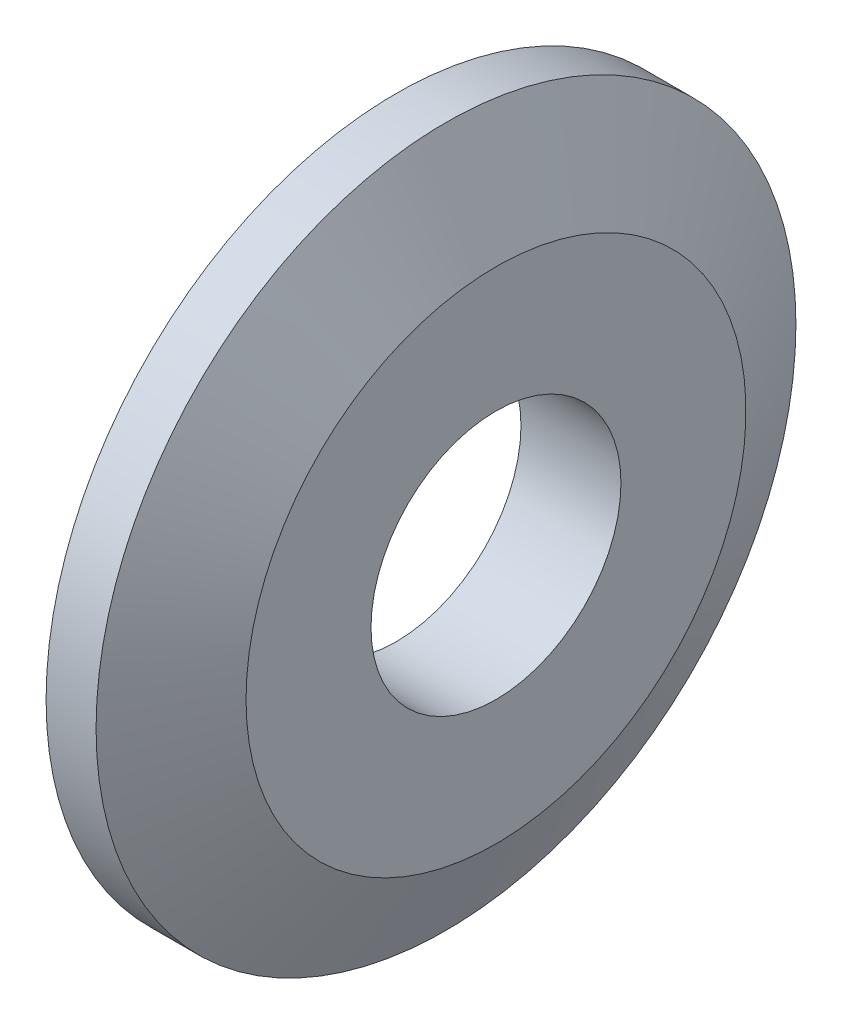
SolidWorks part; units mm, degrees
ref_plane "Plan de face" through (0, 0, 0) normal (0, 0, 1) x (1, 0, 0)
ref_plane "Plan de dessus" through (0, 0, 0) normal (0, 1, 0) x (1, 0, 0)
ref_plane "Plan de droite" through (0, 0, 0) normal (1, 0, 0) x (0, 0, -1)
sketch "Esquisse1" plane through (0, 0, 0) normal (0, 0, 1) x (1, 0, 0)
  line L0 (0, 2.5) -> (0, 7)
  line L1 (0, 7) -> (1, 7)
  line L2 (1, 7) -> (2, 5)
  line L3 (2, 5) -> (2, 2.5)
  line L4 (2, 2.5) -> (0, 2.5)
  line L5 (0, 0) -> (13.7083, 0) construction
  dimension "D1" = 7
  dimension "D2" = 2.5
  dimension "D3" = 5
  dimension "D4" = 2
  dimension "D5" = 1
revolve "Révolution1" add sketch "Esquisse1" angle 360 about L5
